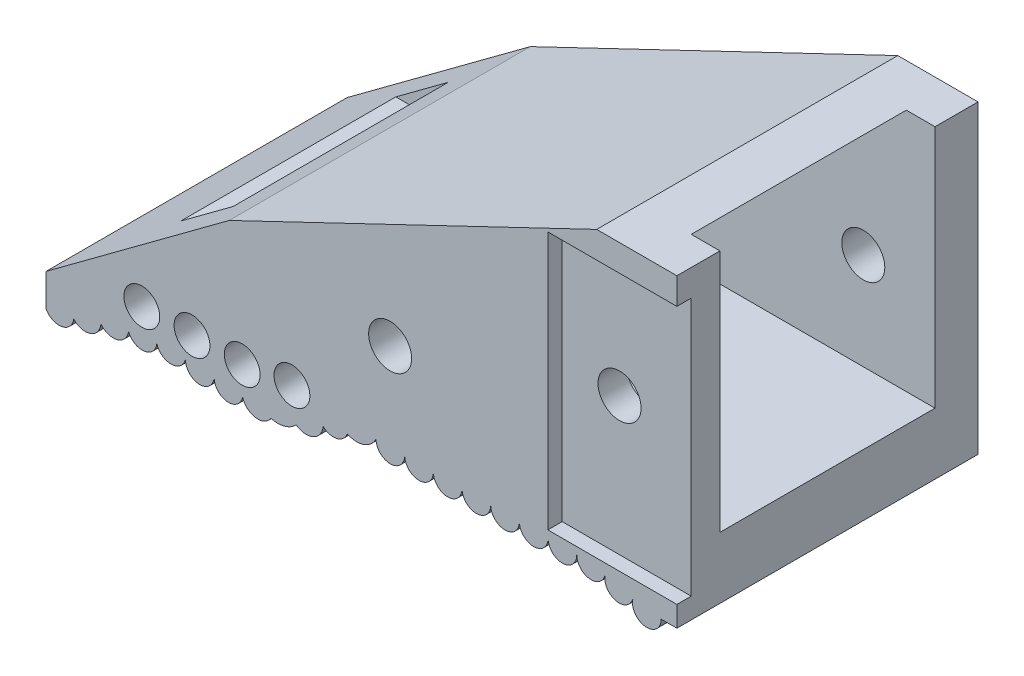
SolidWorks part; units mm, degrees
ref_plane "前视基准面" through (0, 0, 0) normal (0, 0, 1) x (1, 0, 0)
ref_plane "上视基准面" through (0, 0, 0) normal (0, 1, 0) x (1, 0, 0)
ref_plane "右视基准面" through (0, 0, 0) normal (1, 0, 0) x (0, 0, -1)
sketch "草图1" plane through (0, 0, 0) normal (0, 0, 1) x (1, 0, 0)
  line L1 (-12.7783, 7.5679) -> (31.2217, 7.5679)
  line L2 (-12.7783, 7.5679) -> (-12.7783, -17.4321)
  line L3 (-12.7783, -17.4321) -> (31.2217, -17.4321)
  line L4 (31.2217, 7.5679) -> (31.2217, -17.4321)
  dimension "D1" = 44
  dimension "D2" = 25
extrude "凸台-拉伸1" add sketch "草图1" along normal blind 3
sketch "草图2" plane through (0, 0, 3) normal (0, 0, 1) x (1, 0, 0)
  line L1 (31.2217, 7.5679) -> (-12.7783, 7.5679) construction
  line L3 (-8.7783, -9.4321) -> (31.2217, -9.4321)
  line L4 (31.2217, -17.4321) -> (31.2217, 7.5679) construction
  line L5 (31.2217, -9.4321) -> (31.2217, -17.4321)
  line L6 (31.2217, -17.4321) -> (-12.7783, -17.4321)
  line L7 (-12.7783, 7.5679) -> (-12.7783, -17.4321) construction
  line L8 (-12.7783, -17.4321) -> (31.2217, -17.4321) construction
  line L9 (-12.7783, -17.4321) -> (-12.7783, 7.5679)
  line L10 (-12.7783, 7.5679) -> (29.2217, 7.5679)
  line L11 (29.2217, 7.5679) -> (-8.7783, -9.4321)
  dimension "D1" = 4
  dimension "D2" = 8
  dimension "D3" = 2
extrude "凸台-拉伸2" add sketch "草图2" along normal blind 15
sketch "草图3" plane through (0, 0, 18) normal (0, 0, 1) x (1, 0, 0)
  line L1 (-12.7783, 7.5679) -> (31.2217, 7.5679)
  line L2 (-12.7783, 7.5679) -> (-12.7783, -17.4321)
  line L3 (-12.7783, -17.4321) -> (31.2217, -17.4321)
  line L4 (31.2217, 7.5679) -> (31.2217, -17.4321)
extrude "凸台-拉伸3" add sketch "草图3" along normal blind 3
sketch "草图4" plane through (0, 0, 21) normal (0, 0, 1) x (1, 0, 0)
  line L6 (0, -4.7041) -> (-12.7783, -14.1708)
  line L8 (25.6269, 7.5679) -> (31.2217, 7.5679)
  line L12 (25.6269, 7.5679) -> (0, -4.7041)
  line L13 (-12.7783, -14.1708) -> (-12.7783, -16.4321)
  line L14 (-12.7783, 7.5679) -> (-12.7783, -17.4321) construction
  line L17 (31.2217, 7.5679) -> (31.2217, -13.7246)
  line L18 (31.2217, -17.4321) -> (31.2217, 7.5679) construction
  line L19 (31.2217, -13.7246) -> (30.1249, -13.7246)
  arc A11 (2.9101, -15.2004) -> (4.6742, -14.7195) centre (3.3889, -13.4805) ccw
  arc A12 (4.6742, -14.7195) -> (6.5533, -13.8712) centre (5.3699, -13.7551) ccw
  arc A13 (6.5533, -13.8712) -> (8.238, -13.4765) centre (7.2648, -13.1151) ccw
  arc A15 (10.2375, -12.7859) -> (12.2375, -12.7859) centre (11.2375, -12.7859) ccw
  arc A16 (12.2375, -12.7859) -> (14.2375, -12.7859) centre (13.2375, -12.7859) ccw
  arc A17 (14.2375, -12.7859) -> (16.2375, -12.7859) centre (15.2375, -12.7859) ccw
  arc A18 (16.2375, -12.7859) -> (18.2375, -12.7859) centre (17.2375, -12.7859) ccw
  arc A19 (18.2375, -12.7859) -> (20.2375, -12.7859) centre (19.2375, -12.7859) ccw
  arc A20 (20.2375, -12.7859) -> (22.2375, -12.7859) centre (21.2375, -12.7859) ccw
  arc A21 (22.2375, -12.7859) -> (24.2375, -12.7859) centre (23.2375, -12.7859) ccw
  arc A22 (24.2375, -12.7859) -> (26.2143, -13) centre (25.2375, -12.7859) ccw
  arc A23 (26.2143, -13) -> (28.158, -13.4693) centre (27.1911, -13.214) ccw
  arc A24 (28.158, -13.4693) -> (30.1249, -13.7246) centre (29.1249, -13.7246) ccw
  arc A28 (-1.0501, -14.6831) -> (0.9345, -14.8905) centre (-0.0508, -14.72) ccw
  arc A35 (0.9345, -14.8905) -> (2.9101, -15.2004) centre (1.9898, -14.6152) ccw
  arc A36 (-3.0488, -14.6135) -> (-1.0501, -14.6831) centre (-2.0494, -14.6462) ccw
  arc A38 (10.2375, -12.7859) -> (8.238, -13.4765) centre (8.8925, -12.1314) cw
  arc A39 (-12.7783, -16.4321) -> (-10.8413, -16.0829) centre (-11.8679, -15.935) ccw
  arc A40 (-10.8413, -16.0829) -> (-8.9516, -15.4295) centre (-10.0391, -15.3435) ccw
  arc A41 (-8.9516, -15.4295) -> (-7.0177, -14.9176) centre (-8.0938, -14.7614) ccw
  arc A42 (-5.0491, -14.6666) -> (-7.0177, -14.9176) centre (-6.0639, -14.5532) cw
  arc A43 (-5.0491, -14.6666) -> (-3.0488, -14.6135) centre (-4.056, -14.3757) ccw
  dimension "D19" = 2
  dimension "D21" = 2
  dimension "D25" = 2
  dimension "D26" = 2
  dimension "D24" = 2
  dimension "D28" = 2
  dimension "D30" = 2
  dimension "D31" = 2
  dimension "D32" = 2
  dimension "D27" = 2
  dimension "D29" = 2
sketch "草图5" plane through (0, 0, 21) normal (0, 0, 1) x (1, 0, 0)
  line L0 (31.2217, -17.4321) -> (31.2217, 7.5679) construction
  line L1 (31.2217, 7.5679) -> (-12.7783, 7.5679) construction
  circle A0 centre (26.2217, -2.6821) radius 1.5
  dimension "D1" = 5
  dimension "D2" = 10.25
extrude "切除-拉伸1" cut sketch "草图4" against normal blind 30 flip side to cut
extrude "切除-拉伸2" cut sketch "草图5" against normal blind 30
sketch "草图6" plane through (0, 0, 21) normal (0, 0, 1) x (1, 0, 0)
  circle A0 centre (11.2217, -6.6821) radius 1.5
  circle A1 centre (26.2217, -2.6821) radius 1.5 construction
  dimension "D1" = 4
  dimension "D2" = 15
extrude "切除-拉伸3" cut sketch "草图6" against normal blind 30
sketch "草图7" plane through (0, 0, 21) normal (0, 0, 1) x (1, 0, 0)
  line L0 (31.2217, -13.7246) -> (31.2217, 7.5679) construction
  line L1 (31.2217, 5.7155) -> (22.2217, 5.7155)
  line L2 (31.2217, 5.7155) -> (31.2217, -12.2845)
  line L3 (31.2217, -12.2845) -> (22.2217, -12.2845)
  line L4 (22.2217, 5.7155) -> (22.2217, -12.2845)
  line L5 (25.6269, 7.5679) -> (0, -4.7041) construction
  dimension "D1" = 9
  dimension "D2" = 18
  dimension "D3" = 0.2
extrude "切除-拉伸6" cut sketch "草图7" against normal blind 1
sketch "草图8" plane through (0, 0, 21) normal (0, 0, 1) x (1, 0, 0)
  line L0 (0, -4.7041) -> (-12.7783, -14.1708) construction
  circle A0 centre (-6.0953, -12.9533) radius 1.25
  circle A1 centre (-2.5953, -12.9533) radius 1.25
  circle A2 centre (0.9047, -12.9533) radius 1.25
  circle A3 centre (4.3736, -12.488) radius 1.25
  dimension "D1" = 3
  dimension "D2" = 3.5
  dimension "D3" = 3.5
  dimension "D4" = 3.5
extrude "切除-拉伸7" cut sketch "草图8" against normal blind 30
